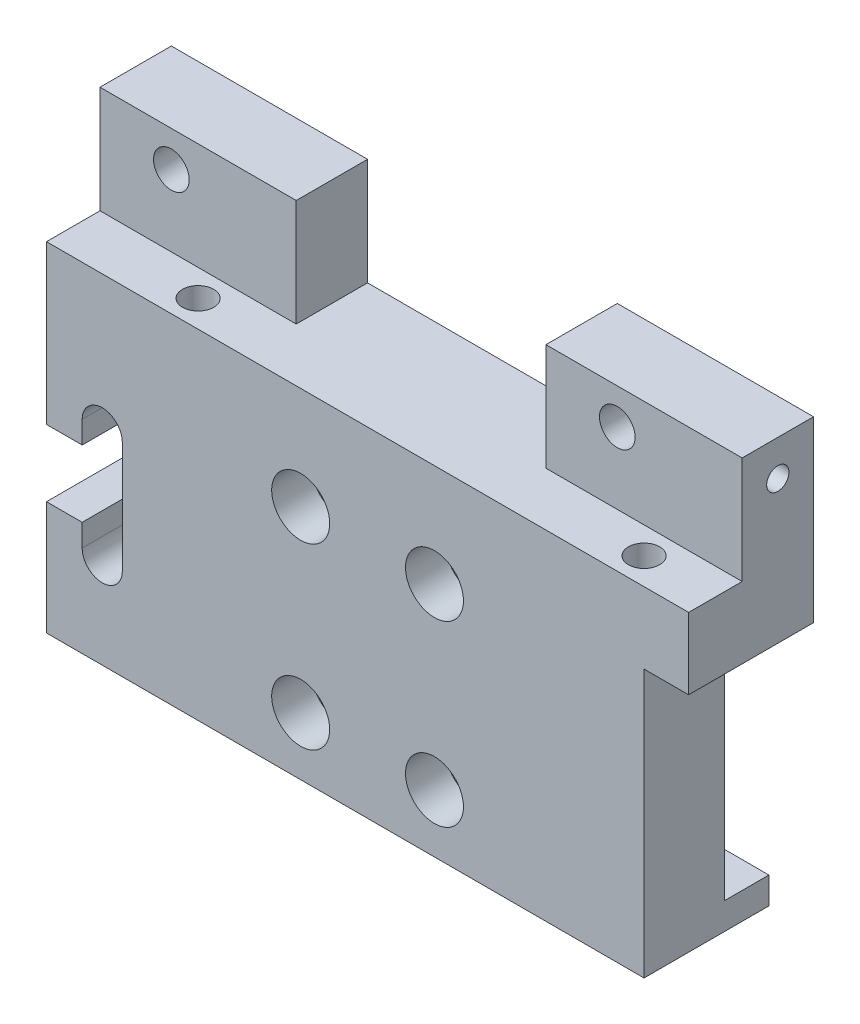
SolidWorks part; units mm, degrees
ref_plane "前视基准面" through (0, 0, 0) normal (0, 0, 1) x (1, 0, 0)
ref_plane "上视基准面" through (0, 0, 0) normal (0, 1, 0) x (1, 0, 0)
ref_plane "右视基准面" through (0, 0, 0) normal (1, 0, 0) x (0, 0, -1)
sketch "草图1" plane through (0, 0, 0) normal (0, 0, 1) x (1, 0, 0)
  line L0 (0, 0) -> (0, 12.75)
  line L1 (22, 38) -> (22, 50)
  line L2 (0, 50) -> (22, 50)
  line L3 (22, 38) -> (50, 38)
  line L4 (0, 0) -> (67, 0)
  line L5 (72, 30) -> (72, 50)
  line L6 (50, 38) -> (50, 50)
  line L7 (50, 50) -> (72, 50)
  line L8 (67, 0) -> (67, 30)
  line L9 (67, 30) -> (72, 30)
  line L10 (4, 10.25) -> (4, 12.75)
  line L11 (8.5, 10.25) -> (8.5, 22.75)
  line L12 (0, 20.25) -> (4, 20.25)
  line L13 (0, 12.75) -> (4, 12.75)
  line L14 (0, 20.25) -> (0, 50)
  line L15 (4, 20.25) -> (4, 22.75)
  circle A0 centre (8, 46) radius 2
  circle A1 centre (58, 46) radius 2
  circle A2 centre (28.5, 6.5) radius 1.75
  circle A3 centre (43.5, 6.5) radius 1.75
  circle A4 centre (28.5, 26.5) radius 1.75
  circle A5 centre (43.5, 26.5) radius 1.75
  arc A6 (4, 10.25) -> (8.5, 10.25) centre (6.25, 10.25) ccw
  arc A7 (8.5, 22.75) -> (4, 22.75) centre (6.25, 22.75) ccw
extrude "凸台-拉伸1" add sketch "草图1" along normal blind 14
sketch "草图2" plane through (0, 0, 14) normal (0, 0, 1) x (1, 0, 0)
  circle A0 centre (28.5, 6.5) radius 3.25
  circle A1 centre (43.5, 6.5) radius 3.25
  circle A2 centre (28.5, 26.5) radius 3.25
  circle A3 centre (43.5, 26.5) radius 3.25
extrude "切除-拉伸1" cut sketch "草图2" against normal blind 4.5
sketch "草图3" plane through (72, 0, 0) normal (1, 0, 0) x (0, 0, -1)
  line L0 (-8, 38) -> (-8, 50)
  line L1 (-14, 0) -> (-14, 38)
  line L2 (0, 30) -> (0, 50)
  line L3 (-14, 0) -> (0, 0)
  line L4 (-14, 38) -> (-8, 38)
  line L5 (-8, 50) -> (0, 50)
  line L6 (-5, 30) -> (0, 30)
  line L7 (-5, 3) -> (-5, 30)
  line L8 (-5, 3.5) -> (-5, 29.5)
  line L9 (-5, 3) -> (0, 3)
  line L10 (0, 3) -> (0, 0)
extrude "切除-拉伸2" cut sketch "草图3" against normal through all flip side to cut contours L4 L0 M3 M4 M1 M2 | L10 L9 L7 L1 L3 M4
sketch "草图4" plane through (72, 0, 0) normal (1, 0, 0) x (0, 0, -1)
  circle A0 centre (-4, 46) radius 1.25
extrude "切除-拉伸3" cut sketch "草图4" against normal blind 14
sketch "草图5" plane through (0, 0, 0) normal (-1, 0, 0) x (0, 0, 1)
  line L0 (8, 50) -> (0, 50) construction
  circle A0 centre (4, 46) radius 1.5
  dimension "D1" = 3
  dimension "D2" = 4
extrude "切除-拉伸4" cut sketch "草图5" against normal blind 8
sketch "草图6" plane through (0, 38, 0) normal (0, 1, 0) x (1, 0, 0)
  circle A0 centre (14, -11) radius 1.75
  circle A1 centre (64, -11) radius 1.75
extrude "切除-拉伸5" cut sketch "草图6" against normal blind 8
